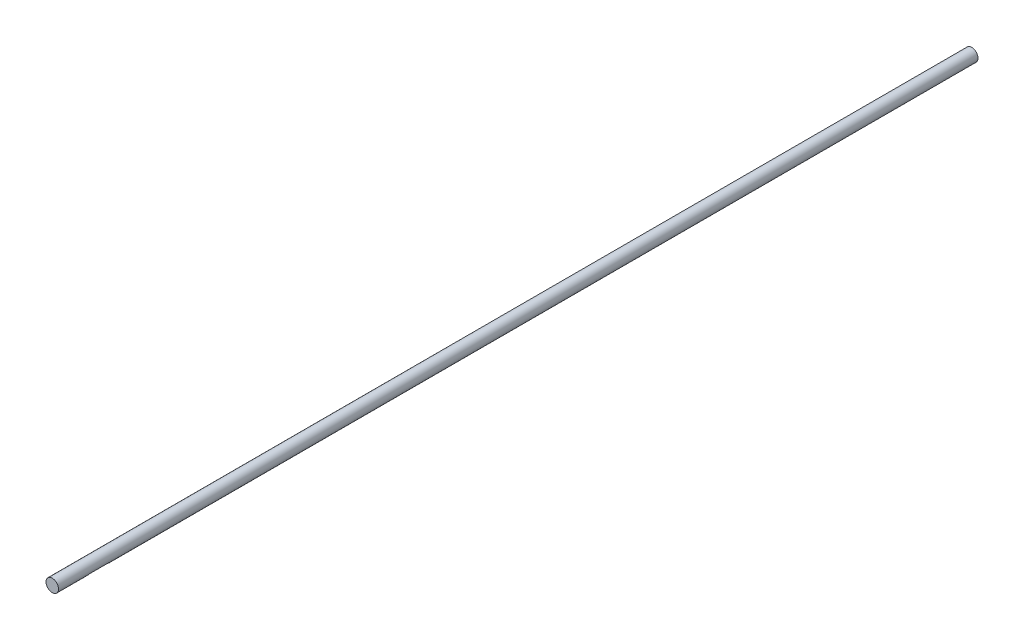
SolidWorks part; units mm, degrees
ref_plane "Face" through (0, 0, 0) normal (0, 0, 1) x (1, 0, 0)
ref_plane "Dessus" through (0, 0, 0) normal (0, 1, 0) x (1, 0, 0)
ref_plane "Droite" through (0, 0, 0) normal (1, 0, 0) x (0, 0, -1)
sketch "Esquisse1" plane through (0, 0, 0) normal (0, 0, 1) x (1, 0, 0)
  circle A0 centre (0, 0) radius 0.6
  dimension "D1" = 1.2
extrude "Extrusion1" add sketch "Esquisse1" along normal blind 88
sketch "Esquisse2" plane through (0, 0, 0) normal (1, 0, 0) x (0, 0, -1)
  line L0 (-88, -0.6) -> (0, -0.6) construction
  line L1 (-83, -0.6) -> (-85, -0.6)
  line L2 (-83, -0.6) -> (-83, -0.3)
  line L3 (-83, -0.3) -> (-85, -0.3)
  line L4 (-85, -0.6) -> (-85, -0.3)
  line L5 (-88, 0.6) -> (-88, -0.6) construction
  dimension "D1" = 2
  dimension "D2" = 3
  dimension "D3" = 0.3
extrude "Extrusion2" cut sketch "Esquisse2" against normal through all and the other way through all
